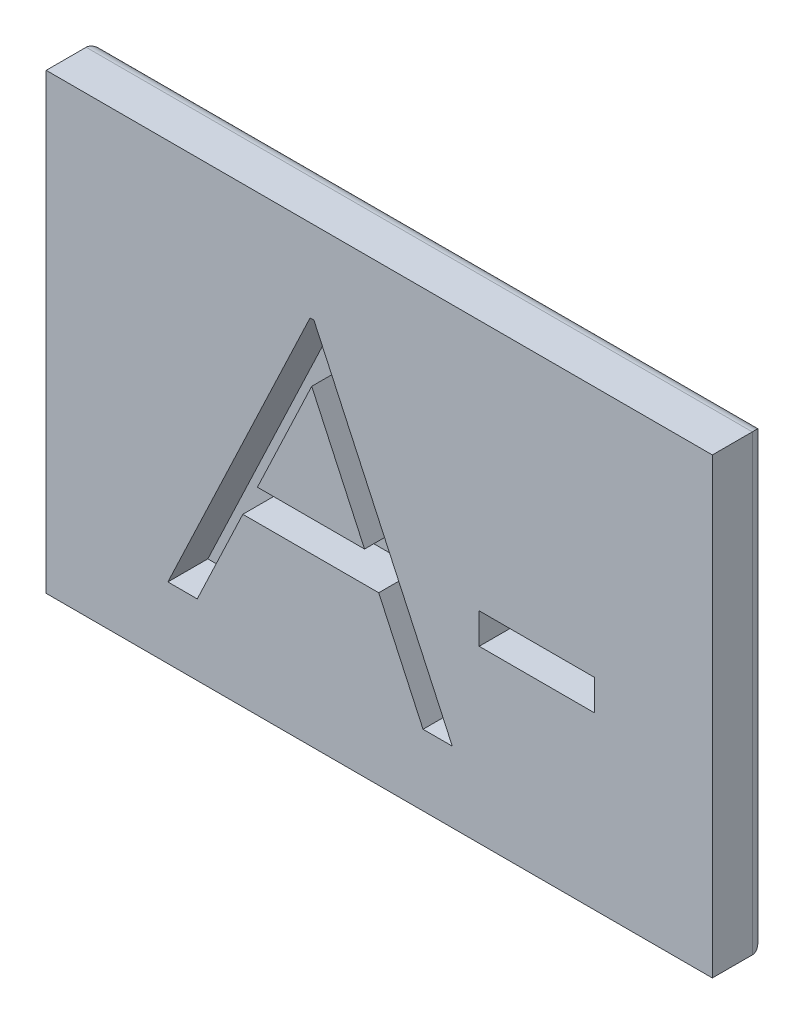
SolidWorks part; units mm, degrees
ref_plane "Front Plane" through (0, 0, 0) normal (0, 0, 1) x (1, 0, 0)
ref_plane "Top Plane" through (0, 0, 0) normal (0, 1, 0) x (1, 0, 0)
ref_plane "Right Plane" through (0, 0, 0) normal (1, 0, 0) x (0, 0, -1)
sketch "Sketch1" plane through (0, 0, 0) normal (0, 0, 1) x (1, 0, 0)
  line L1 (-15.875, -10.795) -> (15.875, -10.795)
  line L2 (-15.875, -10.795) -> (-15.875, 10.795)
  line L3 (-15.875, 10.795) -> (15.875, 10.795)
  line L4 (15.875, -10.795) -> (15.875, 10.795)
  line L5 (-15.875, -10.795) -> (15.875, 10.795) construction
  line L6 (-15.875, 10.795) -> (15.875, -10.795) construction
  point P0 (0, 0)
  dimension "D1" = 31.75
  dimension "D2" = 21.59
extrude "Boss-Extrude1" add sketch "Sketch1" along normal blind 2.54
fillet "Fillet1" radius 0.635 4 edges at (-15.875, 0, 0) (0, -10.795, 0) (0, 10.795, 0) (15.875, 0, 0)
sketch "Sketch2" plane through (0, 0, 2.54) normal (0, 0, 1) x (1, 0, 0)
  line L0 (-15.875, 10.795) -> (-14.977, 9.897) construction
  line L2 (-14.977, 9.897) -> (-14.977, 4.9485) construction
  line L3 (-14.977, 4.9485) -> (-14.977, 0) construction
  line L4 (-14.977, 0) -> (-14.977, -4.9485) construction
  line L5 (-14.977, -4.9485) -> (-14.977, -9.897) construction
  line L6 (-14.977, -9.897) -> (-15.875, -10.795) construction
  line L7 (15.875, 10.795) -> (-15.875, 10.795) construction
  line L8 (-15.875, -10.795) -> (15.875, -10.795) construction
  line L9 (-14.977, 4.9485) -> (14.977, 4.9485) construction
  line L10 (14.977, 4.9485) -> (14.977, 0) construction
  line L11 (14.977, 0) -> (-14.977, 0) construction
  line L12 (14.977, 0) -> (14.977, -4.9485) construction
  line L13 (14.977, -4.9485) -> (-14.977, -4.9485) construction
  line L14 (-14.977, -9.897) -> (14.977, -9.897) construction
  line L15 (14.977, -9.897) -> (14.977, -4.9485) construction
  line L16 (-14.977, 9.897) -> (14.977, 9.897) construction
  line L17 (14.977, 9.897) -> (14.977, 4.9485) construction
  line L18 (14.977, 9.897) -> (15.875, 10.795) construction
  line L19 (14.977, -9.897) -> (15.875, -10.795) construction
  line L20 (-14.977, -7.4227) -> (14.977, -7.4227) construction
  text T0 "A-" font "Century Gothic" height 14.2875
  dimension "D1" = 45
  dimension "D2" = 45
  dimension "D3" = 1.27
extrude "Cut-Extrude1" cut sketch "Sketch2" against normal blind 1.905
